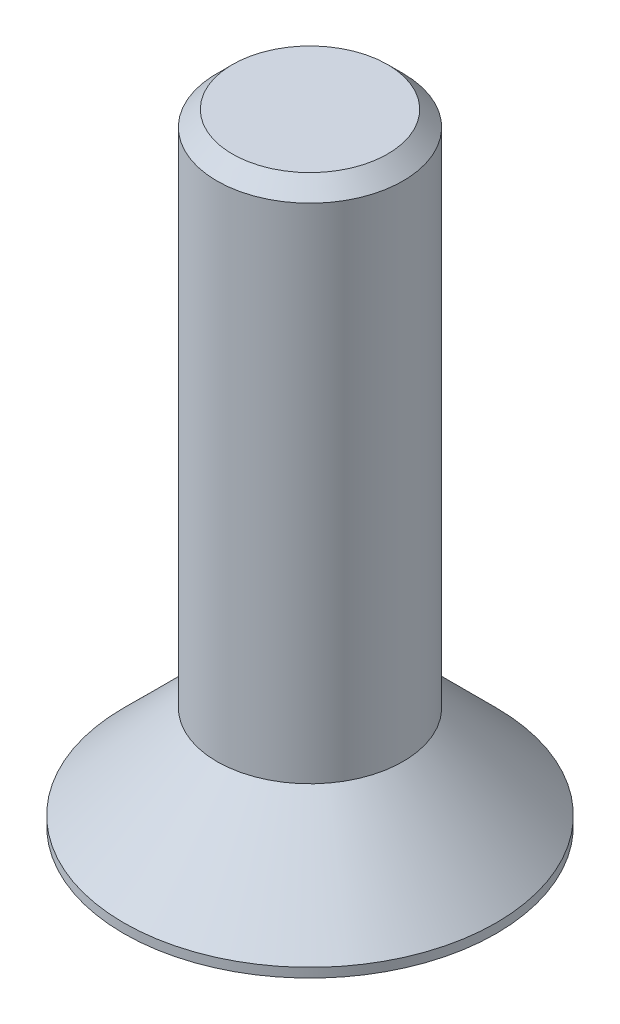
SolidWorks part; units mm, degrees
ref_plane "Plan de face" through (0, 0, 0) normal (0, 0, 1) x (1, 0, 0)
ref_plane "Plan de dessus" through (0, 0, 0) normal (0, 1, 0) x (1, 0, 0)
ref_plane "Plan de droite" through (0, 0, 0) normal (1, 0, 0) x (0, 0, -1)
sketch "Esquisse1" plane through (0, 0, 0) normal (0, 0, 1) x (1, 0, 0)
  line L0 (0, 0) -> (0, 35.9816) construction
  line L1 (0, -55) -> (0, 55) construction
  line L2 (0, 0) -> (-6, 0)
  line L3 (-6, 0) -> (-6, 0.3)
  line L4 (-6, 0.3) -> (-3, 3.3)
  line L5 (-3, 3.3) -> (-3, 20)
  line L6 (-3, 20) -> (0, 20)
  line L7 (0, 20) -> (0, 0)
  dimension "D1" = 6
  dimension "D2" = 45
  dimension "D3" = 12
  dimension "D4" = 3.3
  dimension "D5" = 20
revolve "Révolution1" add sketch "Esquisse1" angle 360 about L0
chamfer "Chanfrein1" distance 0.5 angle 45 1 edges at (0, 20, -3)
sketch "Esquisse3" plane through (0, 0, 0) normal (0, -1, 0) x (1, 0, 0)
  line L1 (2, 1.1547) -> (0, 2.3094)
  line L2 (0, 2.3094) -> (-2, 1.1547)
  line L3 (-2, 1.1547) -> (-2, -1.1547)
  line L4 (-2, -1.1547) -> (0, -2.3094)
  line L5 (0, -2.3094) -> (2, -1.1547)
  line L6 (2, -1.1547) -> (2, 1.1547)
  circle A1 centre (0, 0) radius 2 construction
  dimension "D1" = 4
extrude "Enlèv. mat.-Extru.1" cut sketch "Esquisse3" against normal blind 2
